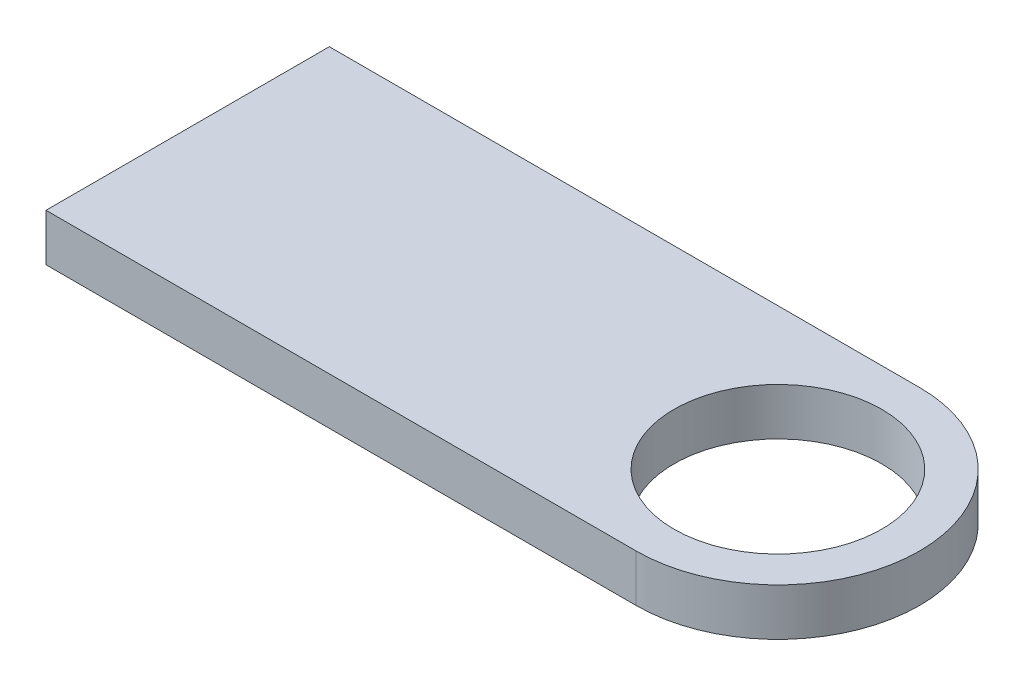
SolidWorks part; units mm, degrees
ref_plane "Plan de face" through (0, 0, 0) normal (0, 0, 1) x (1, 0, 0)
ref_plane "Plan de dessus" through (0, 0, 0) normal (0, 1, 0) x (1, 0, 0)
ref_plane "Plan de droite" through (0, 0, 0) normal (1, 0, 0) x (0, 0, -1)
ref_plane "Plan1" through (0, 5, 0) normal (0, 1, 0) x (1, 0, 0)
sketch "Esquisse1" plane through (0, 5, 0) normal (0, 1, 0) x (1, 0, 0)
  line L0 (0, 60) -> (0, 0)
  line L1 (0, 0) -> (125, 0)
  line L2 (125, 60) -> (0, 60)
  circle A0 centre (125, 30) radius 22
  arc A1 (125, 0) -> (125, 60) centre (125, 30) ccw
  dimension "D3" = 44
  dimension "D1" = 60
  dimension "D2" = 125
extrude "Boss.-Extru.1" add sketch "Esquisse1" against normal blind 10
